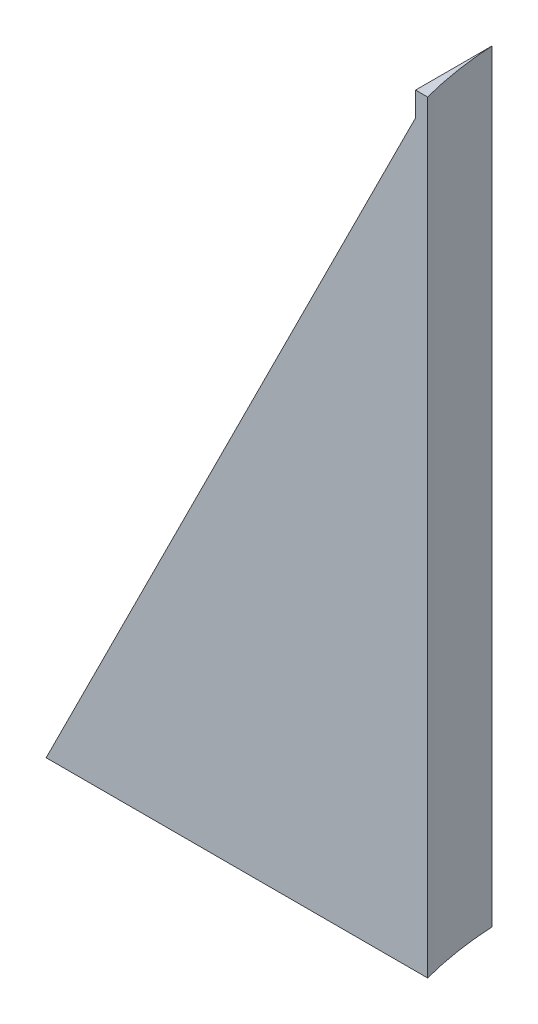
SolidWorks part; units mm, degrees
ref_plane "Plan de face" through (0, 0, 0) normal (0, 0, 1) x (1, 0, 0)
ref_plane "Plan de dessus" through (0, 0, 0) normal (0, 1, 0) x (1, 0, 0)
ref_plane "Plan de droite" through (0, 0, 0) normal (1, 0, 0) x (0, 0, -1)
sketch "Esquisse1" plane through (0, 0, 0) normal (0, 1, 0) x (1, 0, 0)
  line L0 (-69.2201, -25.5374) -> (30.7799, -25.5374)
  line L1 (-69.2201, -5.5374) -> (27.6216, -5.5374)
  line L4 (-69.2201, -25.5374) -> (-69.2201, -5.5374)
  circle A0 centre (127.4693, -0.0195) radius 100
  point P0 (0, 0)
  dimension "D3" = 200
  dimension "D1" = 20
  dimension "D2" = 100
extrude "Boss.-Extru.2" add sketch "Esquisse1" along normal blind 200 contours A0 L1 L4 L0
sketch "Esquisse3" plane through (0, 0, 25.5374) normal (0, 0, 1) x (1, 0, 0)
  line L0 (30.7799, 200) -> (-69.2201, 0)
  line L2 (-69.2201, 200) -> (27.6216, 200)
  line L3 (-69.2201, 200) -> (-69.2201, 0)
  line L4 (-69.2201, 0) -> (27.6216, 0)
  line L5 (27.6216, 200) -> (27.6216, 0)
extrude "Enlèv. mat.-Extru.1" cut sketch "Esquisse3" against normal blind 200 contours L5 L0 M4 M5
